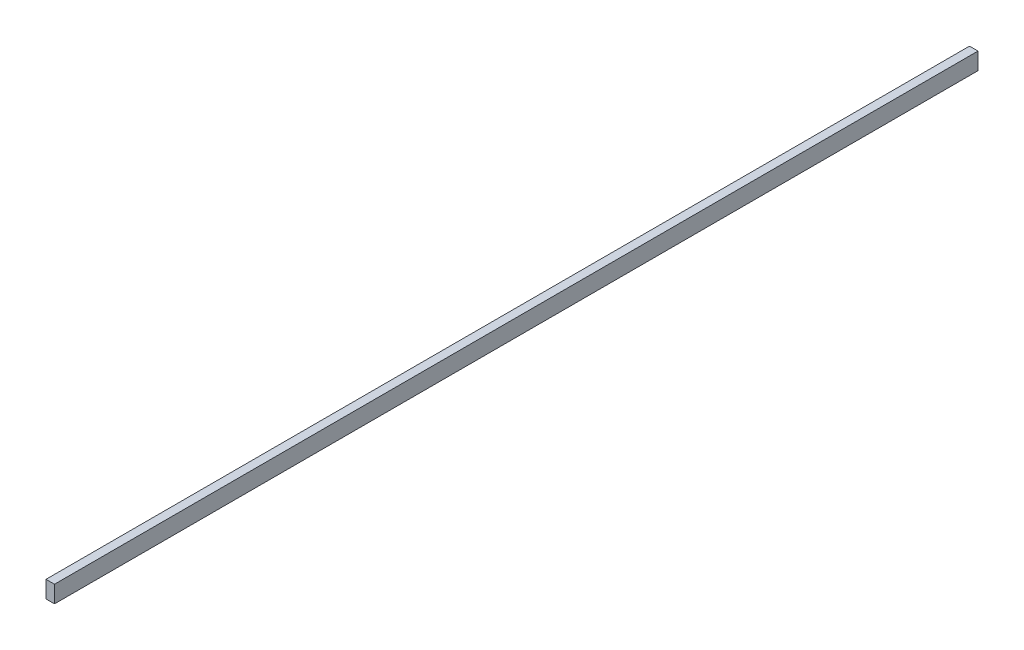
SolidWorks part; units mm, degrees
ref_plane "Face" through (0, 0, 0) normal (0, 0, 1) x (1, 0, 0)
ref_plane "Dessus" through (0, 0, 0) normal (0, 1, 0) x (1, 0, 0)
ref_plane "Droite" through (0, 0, 0) normal (1, 0, 0) x (0, 0, -1)
sketch "Esquisse1" plane through (0, 0, 0) normal (0, 0, 1) x (1, 0, 0)
  line L1 (0, 0) -> (5, 0)
  line L2 (0, 0) -> (0, 10)
  line L3 (0, 10) -> (5, 10)
  line L4 (5, 0) -> (5, 10)
  dimension "D1" = 5
  dimension "D2" = 10
extrude "Extrusion1" add sketch "Esquisse1" along normal blind 542.31
